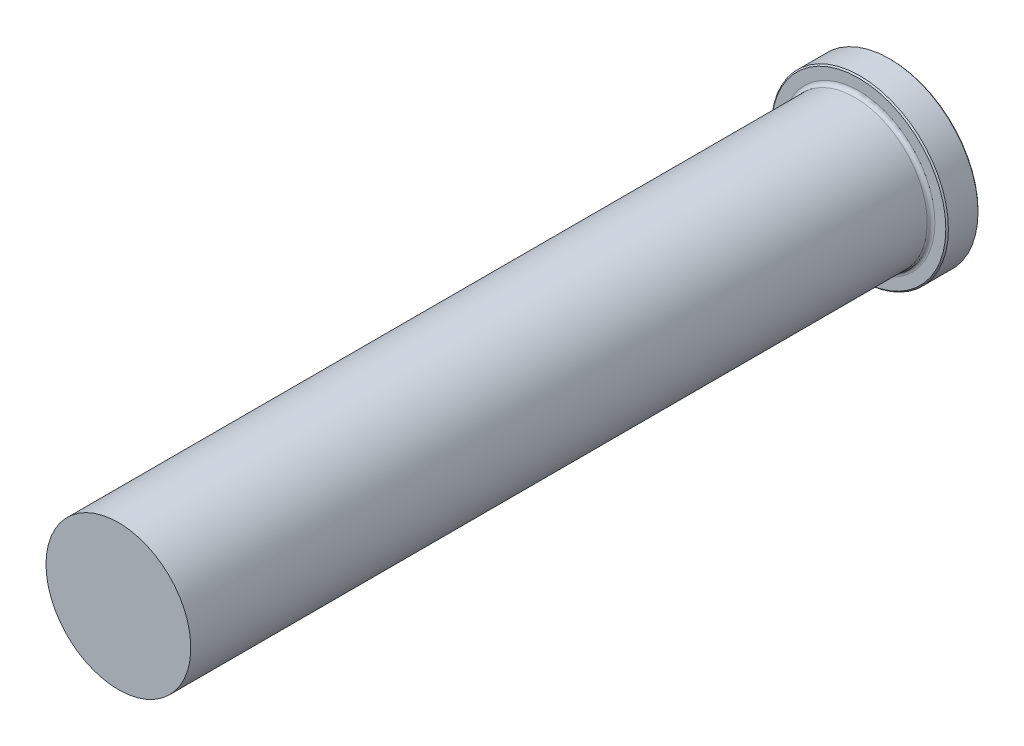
SolidWorks part; units mm, degrees
ref_plane "Front Plane" through (0, 0, 0) normal (0, 0, 1) x (1, 0, 0)
ref_plane "Top Plane" through (0, 0, 0) normal (0, 1, 0) x (1, 0, 0)
ref_plane "Right Plane" through (0, 0, 0) normal (1, 0, 0) x (0, 0, -1)
sketch "Sketch1" plane through (0, 0, 0) normal (1, 0, 0) x (0, 0, -1)
  line L0 (0, 0) -> (-156.8087, 0) construction
  line L1 (0, 0) -> (0, 17.4625)
  line L2 (0, 17.4625) -> (-6.35, 17.4625)
  line L3 (-6.35, 17.4625) -> (-6.35, 14.2875)
  line L4 (-6.35, 14.2875) -> (-152.4, 14.2875)
  line L5 (-152.4, 14.2875) -> (-152.4, 0)
  line L6 (-152.4, 0) -> (0, 0)
  dimension "D1" = 34.925
  dimension "D2" = 28.575
  dimension "D3" = 6.35
  dimension "D4" = 152.4
revolve "Revolve1" add sketch "Sketch1" angle 360 about L0
fillet "Fillet1" radius 0.762 1 edges at (-14.2875, 0, 6.35)
chamfer "Chamfer1" distance 0.254 angle 45 2 edges at (-17.4625, 0, 0) (-17.4625, 0, 6.35)
